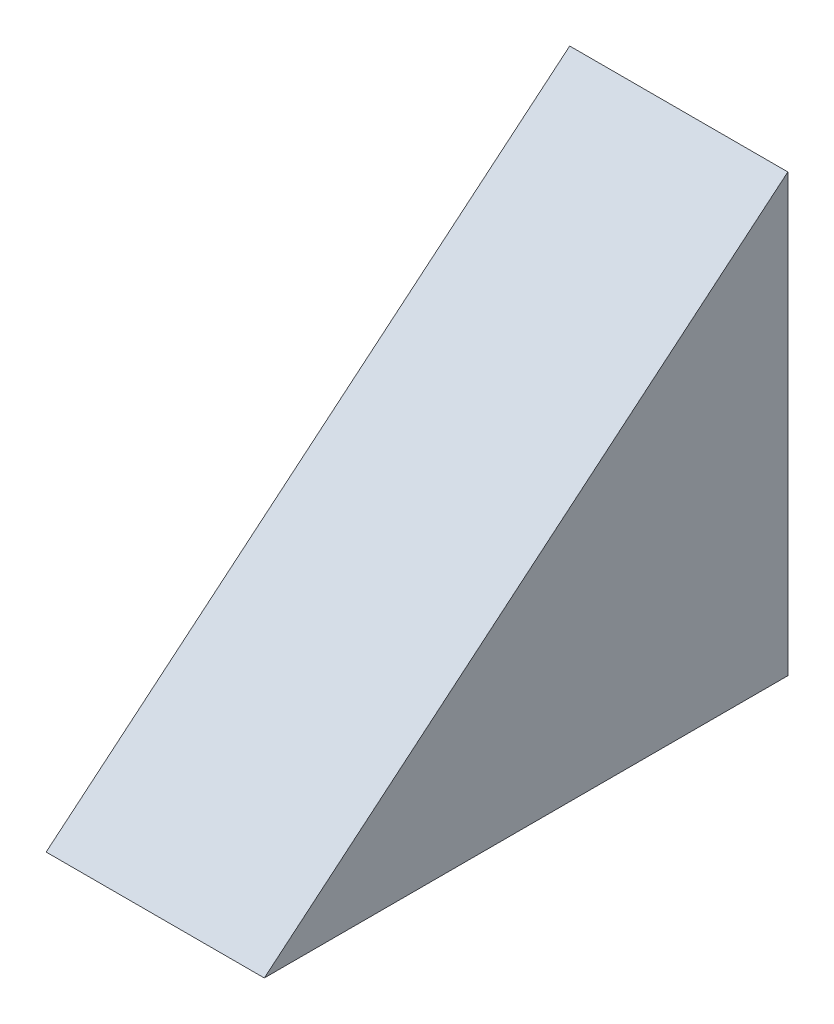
SolidWorks part; units mm, degrees
ref_plane "前视基准面" through (0, 0, 0) normal (0, 0, 1) x (1, 0, 0)
ref_plane "上视基准面" through (0, 0, 0) normal (0, 1, 0) x (1, 0, 0)
ref_plane "右视基准面" through (0, 0, 0) normal (1, 0, 0) x (0, 0, -1)
sketch "草图3" plane through (0, 0, 0) normal (1, 0, 0) x (0, 0, -1)
  line L0 (-8, 18) -> (-20, 8)
  line L1 (-8, 30) -> (-8, 8) construction
  line L2 (0, 8) -> (-23, 8) construction
  line L3 (-8, 18) -> (-8, 8)
  line L4 (-8, 8) -> (-20, 8)
  dimension "D1" = 12
  dimension "D2" = 10
extrude "凸台-拉伸8" add sketch "草图3" along normal mid plane 5 separate body
